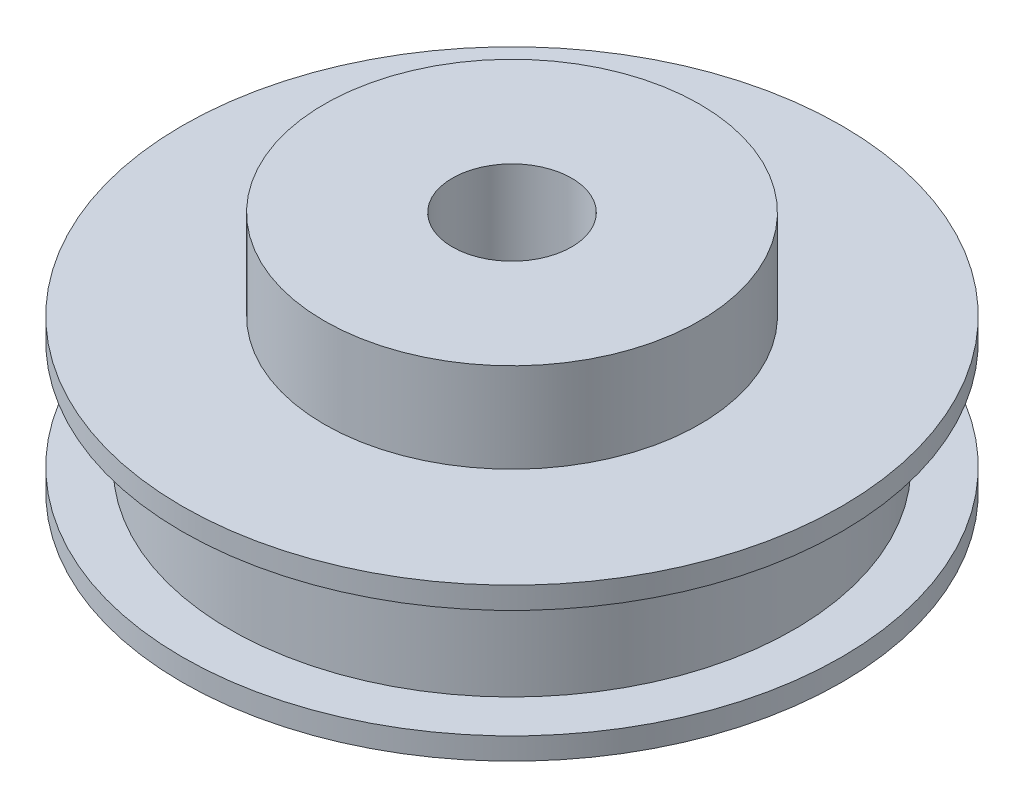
SolidWorks part; units mm, degrees
ref_plane "Front Plane" through (0, 0, 0) normal (0, 0, 1) x (1, 0, 0)
ref_plane "Top Plane" through (0, 0, 0) normal (0, 1, 0) x (1, 0, 0)
ref_plane "Right Plane" through (0, 0, 0) normal (1, 0, 0) x (0, 0, -1)
sketch "Sketch1" plane through (0, 0, 0) normal (0, 1, 0) x (1, 0, 0)
  circle A0 centre (0, 0) radius 21.971
  dimension "D1" = 43.942
extrude "Boss-Extrude1" add sketch "Sketch1" along normal blind 10.16
sketch "Sketch2" plane through (0, 0, 0) normal (0, 0, 1) x (1, 0, 0)
  line L0 (-21.971, 10.16) -> (-21.971, 0) construction
  line L1 (-21.971, 8.6995) -> (-21.971, 1.4605)
  line L2 (-21.971, 1.4605) -> (-18.796, 1.4605)
  line L3 (-18.796, 1.4605) -> (-18.796, 8.6995)
  line L4 (-18.796, 8.6995) -> (-21.971, 8.6995)
  line L5 (-18.796, 8.6995) -> (-18.796, 10.16) construction
  line L6 (-18.796, 10.16) -> (-21.971, 10.16) construction
  line L7 (-21.971, 0) -> (-18.796, 0) construction
  line L8 (-18.796, 0) -> (-18.796, 1.4605) construction
  line L9 (0, 0) -> (0, 50000) construction
  dimension "D1" = 3.175
  dimension "D2" = 7.239
revolve "Cut-Revolve1" cut sketch "Sketch2" angle 360 about L9
sketch "Sketch3" plane through (0, 10.16, 0) normal (0, 1, 0) x (1, 0, 0)
  circle A0 centre (0, 0) radius 12.5095
  dimension "D1" = 25.019
extrude "Boss-Extrude2" add sketch "Sketch3" along normal blind 5.969
sketch "Sketch4" plane through (0, 16.129, 0) normal (0, 1, 0) x (1, 0, 0)
  circle A0 centre (0, 0) radius 3.9751
  dimension "D1" = 7.9502
extrude "Cut-Extrude1" cut sketch "Sketch4" against normal through all
